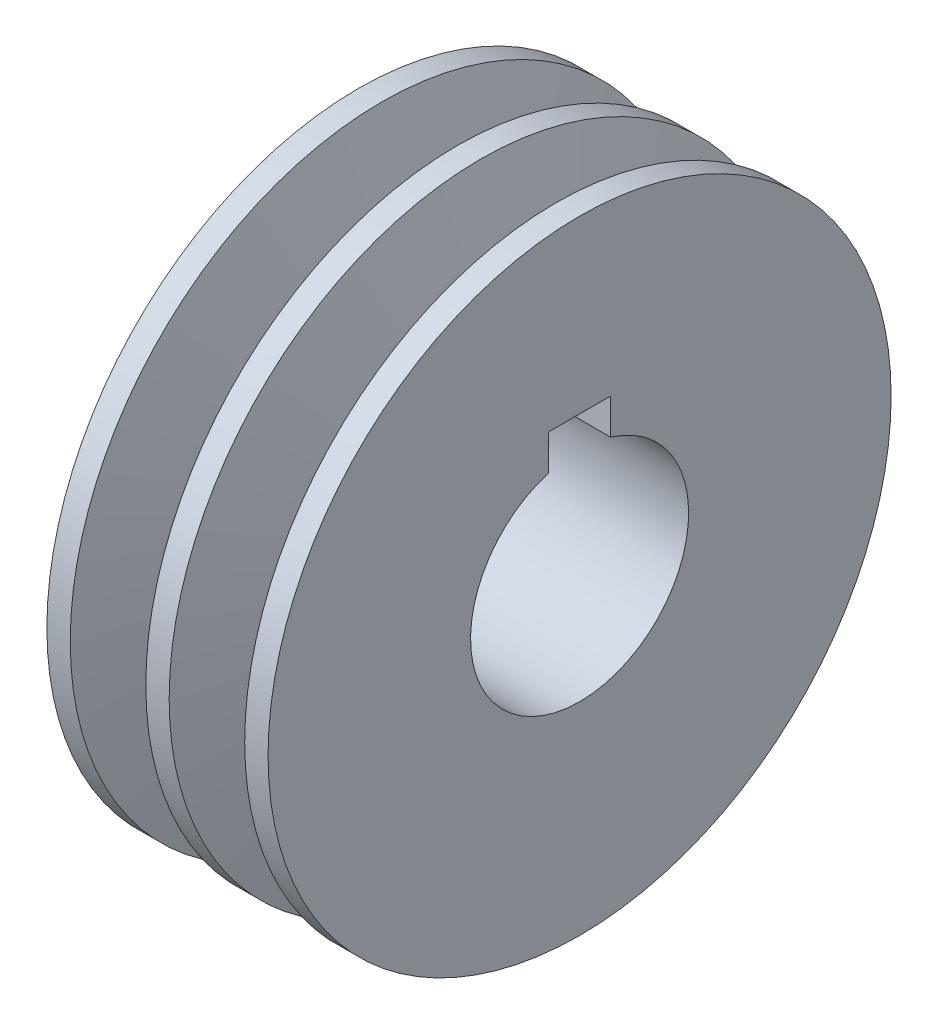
SolidWorks part; units mm, degrees
ref_plane "Ebene vorne" through (0, 0, 0) normal (0, 0, 1) x (1, 0, 0)
ref_plane "Ebene oben" through (0, 0, 0) normal (0, 1, 0) x (1, 0, 0)
ref_plane "Ebene rechts" through (0, 0, 0) normal (1, 0, 0) x (0, 0, -1)
sketch "Skizze1" plane through (0, 0, 0) normal (0, 0, 1) x (1, 0, 0)
  line L0 (0, 0) -> (28.4, 0) construction
  line L1 (0, 0) -> (0, 40)
  line L2 (0, 40) -> (3, 40)
  line L3 (3, 40) -> (6.1166, 27.5)
  line L4 (6.1166, 27.5) -> (9.5834, 27.5)
  line L5 (9.5834, 27.5) -> (12.7, 40)
  line L6 (12.7, 40) -> (15.7, 40)
  line L7 (15.7, 40) -> (18.8166, 27.5)
  line L8 (18.8166, 27.5) -> (22.2834, 27.5)
  line L9 (22.2834, 27.5) -> (25.4, 40)
  line L10 (25.4, 40) -> (28.4, 40)
  line L11 (28.4, 40) -> (28.4, 0)
  line L12 (0, 0) -> (28.4, 0)
  dimension "D1" = 28.4
  dimension "D2" = 3
  dimension "D3" = 12.7
  dimension "D4" = 14
  dimension "D5" = 80
  dimension "D6" = 55
revolve "Rotation1" add sketch "Skizze1" angle 360 about L0
sketch "Skizze2" plane through (28.4, 0, 0) normal (1, 0, 0) x (0, 0, -1)
  line L1 (-4, 13.4164) -> (4, 13.4164)
  line L2 (-4, 13.4164) -> (-4, 18)
  line L3 (-4, 18) -> (4, 18)
  line L4 (4, 13.4164) -> (4, 18)
  circle A0 centre (0, 0) radius 14
  dimension "D2" = 28
  dimension "D1" = 8
  dimension "D3" = 18
extrude "Schnitt-Linear austragen1" cut sketch "Skizze2" against normal through all contours L1 A0 | A0 L4 L3 L2 | L1 A0
